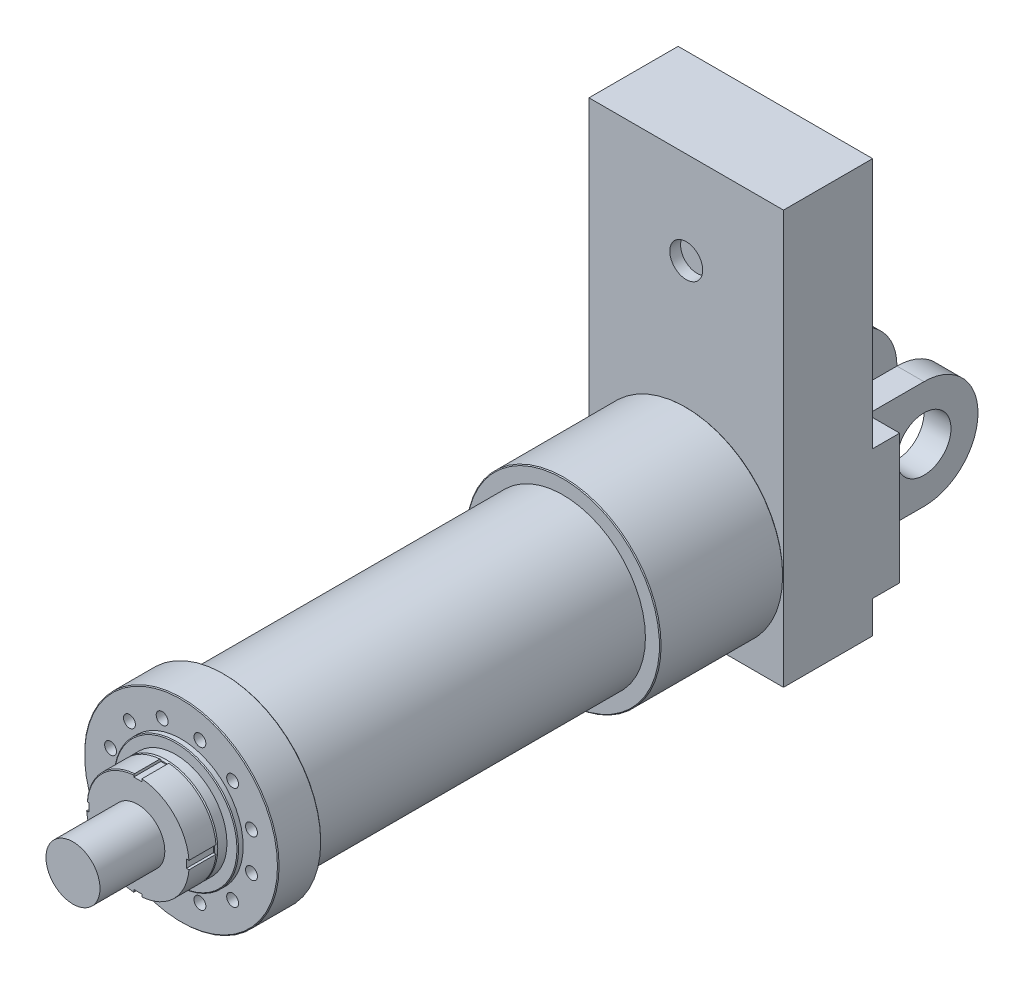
SolidWorks part; units mm, degrees
ref_plane "前视基准面" through (0, 0, 0) normal (0, 0, 1) x (1, 0, 0)
ref_plane "上视基准面" through (0, 0, 0) normal (0, 1, 0) x (1, 0, 0)
ref_plane "右视基准面" through (0, 0, 0) normal (1, 0, 0) x (0, 0, -1)
sketch "草图1" plane through (0, 0, 0) normal (0, 0, 1) x (1, 0, 0)
  circle A0 centre (0, 0) radius 152.5
  dimension "D1" = 305
extrude "凸台-拉伸1" add sketch "草图1" along normal blind 627
sketch "草图2" plane through (0, 0, 627) normal (0, 0, 1) x (1, 0, 0)
  line L0 (0, 0) -> (224.9367, 0) construction
  line L1 (0, 0) -> (223.5406, 59.8975) construction
  circle A0 centre (0, 0) radius 180
  circle A1 centre (0, 0) radius 135 construction
  circle A2 centre (130.4, 34.9406) radius 11
  circle A3 centre (130.4, -34.9406) radius 11
  circle A4 centre (95.4594, -95.4594) radius 11
  circle A5 centre (34.9406, -130.4) radius 11
  circle A6 centre (-34.9406, -130.4) radius 11
  circle A7 centre (-95.4594, -95.4594) radius 11
  circle A8 centre (-130.4, -34.9406) radius 11
  circle A9 centre (-130.4, 34.9406) radius 11
  circle A10 centre (-95.4594, 95.4594) radius 11
  circle A11 centre (-34.9406, 130.4) radius 11
  circle A12 centre (34.9406, 130.4) radius 11
  circle A13 centre (95.4594, 95.4594) radius 11
  point P32 (0, 0)
  dimension "D1" = 360
  dimension "D2" = 270
  dimension "D3" = 22
  dimension "D4" = 15
  dimension "D5" = 12
extrude "凸台-拉伸2" add sketch "草图2" along normal blind 80
sketch "草图3" plane through (0, 0, 707) normal (0, 0, 1) x (1, 0, 0)
  circle A0 centre (0, 0) radius 115
  dimension "D1" = 230
extrude "凸台-拉伸3" add sketch "草图3" along normal blind 10
sketch "草图4" plane through (0, 0, 717) normal (0, 0, 1) x (1, 0, 0)
  circle A0 centre (0, 0) radius 95
  dimension "D1" = 190
extrude "凸台-拉伸4" add sketch "草图4" along normal blind 20
chamfer "倒角1" distance 3 angle 45 1 edges at (95, 0, 737)
sketch "草图5" plane through (0, 0, 737) normal (0, 0, 1) x (1, 0, 0)
  line L0 (-7.5, 94.7035) -> (-7.5, 90)
  line L1 (-7.5, 90) -> (7.5, 90)
  line L2 (7.5, 90) -> (7.5, 94.7035)
  line L3 (94.7035, 7.5) -> (90, 7.5)
  line L4 (90, 7.5) -> (90, -7.5)
  line L5 (90, -7.5) -> (94.7035, -7.5)
  line L6 (7.5, -94.7035) -> (7.5, -90)
  line L7 (7.5, -90) -> (-7.5, -90)
  line L8 (-7.5, -90) -> (-7.5, -94.7035)
  line L9 (-94.7035, -7.5) -> (-90, -7.5)
  line L10 (-90, -7.5) -> (-90, 7.5)
  line L11 (-90, 7.5) -> (-94.7035, 7.5)
  arc A0 (-7.5, 94.7035) -> (-94.7035, 7.5) centre (0, 0) ccw
  arc A1 (-94.7035, -7.5) -> (-7.5, -94.7035) centre (0, 0) ccw
  arc A2 (7.5, -94.7035) -> (94.7035, -7.5) centre (0, 0) ccw
  arc A3 (94.7035, 7.5) -> (7.5, 94.7035) centre (0, 0) ccw
  point P21 (0, 0)
  dimension "D1" = 190
  dimension "D2" = 15
  dimension "D3" = 7.5
  dimension "D4" = 90
  dimension "D5" = 4
extrude "凸台-拉伸5" add sketch "草图5" along normal blind 50
chamfer "倒角2" distance 1.5 angle 45 5 edges at (180, 0, 627) (180, 0, 707) (115, 0, 717) (-67.1751, 67.1751, 737) (-67.1751, 67.1751, 787)
sketch "草图11" plane through (0, 0, 0) normal (0, 0, -1) x (-1, 0, 0)
  circle A0 centre (0, 0) radius 180
  dimension "D1" = 360
extrude "凸台-拉伸10" add sketch "草图11" along normal blind 228
chamfer "倒角5" distance 1.5 angle 45 2 edges at (-180, 0, 0) (-180, 0, -228)
sketch "草图12" plane through (0, 0, -228) normal (0, 0, -1) x (-1, 0, 0)
  line L0 (71.9375, 585) -> (180, 585)
  line L1 (-87.178, -180) -> (87.178, -180)
  line L2 (-180, -87.178) -> (-180, 420)
  line L3 (-71.9375, 585) -> (71.9375, 585)
  line L4 (180, -87.178) -> (180, 420)
  line L5 (180, 585) -> (180, 420)
  line L6 (-71.9375, 585) -> (-180, 585)
  line L7 (-180, 585) -> (-180, 420)
  line L8 (-180, -87.178) -> (-180, -180)
  line L9 (-180, -180) -> (-87.178, -180)
  line L10 (87.178, -180) -> (180, -180)
  line L11 (180, -180) -> (180, -87.178)
  dimension "D2" = 180
  dimension "D3" = 180
extrude "凸台-拉伸11" add sketch "草图12" along normal blind 165 separate body
ref_plane "基准面1" through (152.5, 0, 0) normal (1, 0, 0) x (0, 0, -1)
ref_plane "基准面2" through (-152.5, 0, 0) normal (1, 0, 0) x (0, 0, -1)
sketch "草图14" plane through (152.5, 0, 0) normal (1, 0, 0) x (0, 0, -1)
  circle A0 centre (-47, 0) radius 16
  dimension "D1" = 32
  dimension "D2" = 47
sketch "草图16" plane through (-152.5, 0, 0) normal (1, 0, 0) x (0, 0, -1)
  line L0 (0, 152.5) -> (0, -152.5) construction
  line L1 (-628.5, 180) -> (-628.5, -180) construction
  circle A0 centre (-27, 0) radius 16
  circle A1 centre (-551.5, 0) radius 16
  dimension "D1" = 32
  dimension "D2" = 27
  dimension "D3" = 32
  dimension "D4" = 77
extrude "切除-拉伸4" cut sketch "草图16" along normal blind 2
sketch "草图18" plane through (0, 0, -228) normal (0, 0, 1) x (1, 0, 0)
  circle A0 centre (0, 414) radius 30.4407
  dimension "D1" = 414
extrude "切除-拉伸6" cut sketch "草图18" against normal blind 20
sketch "草图19" plane through (0, 0, 787) normal (0, 0, 1) x (1, 0, 0)
  circle A0 centre (0, 0) radius 50
  dimension "D1" = 100
extrude "凸台-拉伸12" add sketch "草图19" along normal blind 120
sketch "草图20" plane through (0, 0, -393) normal (0, 0, -1) x (-1, 0, 0)
  line L6 (180, -180) -> (180, 585) construction
  line L7 (-180, 120) -> (180, 120)
  line L8 (-180, 120) -> (-180, -120)
  line L9 (-180, -120) -> (180, -120)
  line L10 (180, 120) -> (180, -120)
  line L11 (-180, 120) -> (180, -120) construction
  line L12 (-180, -120) -> (180, 120) construction
  point P0 (0, 0)
  dimension "D1" = 240
extrude "凸台-拉伸13" add sketch "草图20" along normal blind 50
sketch "草图21" plane through (0, 0, -443) normal (0, 0, -1) x (-1, 0, 0)
  line L0 (-75, 0) -> (75, 0) construction
  line L2 (-100, 100) -> (-50, 100)
  line L3 (-100, 100) -> (-100, -100)
  line L4 (-100, -100) -> (-50, -100)
  line L5 (-50, 100) -> (-50, -100)
  line L6 (-100, 100) -> (-50, -100) construction
  line L7 (-100, -100) -> (-50, 100) construction
  line L8 (50, 100) -> (100, 100)
  line L9 (50, 100) -> (50, -100)
  line L10 (50, -100) -> (100, -100)
  line L11 (100, 100) -> (100, -100)
  line L12 (50, 100) -> (100, -100) construction
  line L13 (50, -100) -> (100, 100) construction
  point P4 (0, 0)
  dimension "D1" = 200
  dimension "D2" = 100
  dimension "D3" = 50
  dimension "D4" = 200
  dimension "D5" = 200
extrude "凸台-拉伸14" add sketch "草图21" along normal blind 225
sketch "草图22" plane through (-100, 0, 0) normal (-1, 0, 0) x (0, 0, 1)
  line L0 (-668, 0) -> (-568, 0) construction
  line L1 (-668, -100) -> (-668, 100) construction
  line L2 (-568, 100) -> (-798.8436, 151.7502)
  line L3 (-798.8436, 151.7502) -> (-792.5027, -179.0368)
  line L4 (-792.5027, -179.0368) -> (-568, -100)
  arc A0 (-568, 100) -> (-568, -100) centre (-568, 0) ccw
  circle A1 centre (-568, 0) radius 50
  dimension "D2" = 100
  dimension "D1" = 100
extrude "切除-拉伸7" cut sketch "草图22" against normal blind 225
chamfer "倒角6" distance 15 angle 45 8 edges at (75, 100, -443) (100, 0, -443) (50, 0, -443) (75, -100, -443) (-50, 0, -443) (-75, -100, -443) (-100, 0, -443) (-75, 100, -443)
